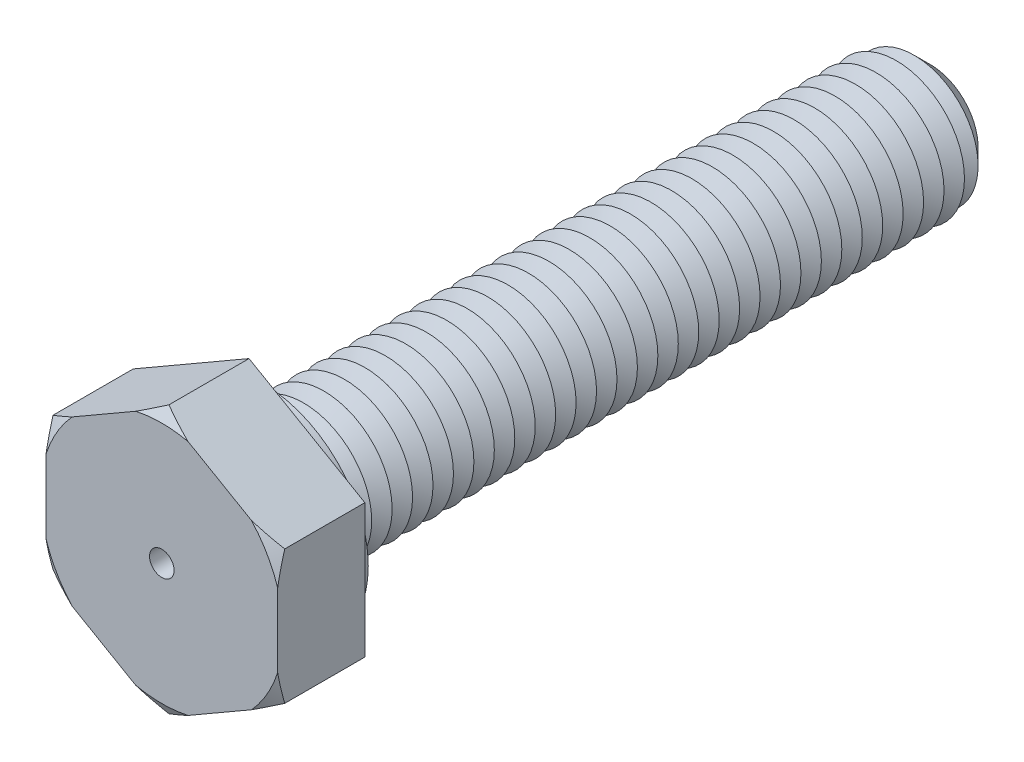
SolidWorks part; units mm, degrees
ref_plane "Front Plane" through (0, 0, 0) normal (0, 0, 1) x (1, 0, 0)
ref_plane "Top Plane" through (0, 0, 0) normal (0, 1, 0) x (1, 0, 0)
ref_plane "Right Plane" through (0, 0, 0) normal (1, 0, 0) x (0, 0, -1)
sketch "Sketch2" plane through (0, 0, 0) normal (0, 0, 1) x (1, 0, 0)
  line L1 (0, 9.815) -> (-8.5, 4.9075)
  line L2 (-8.5, 4.9075) -> (-8.5, -4.9075)
  line L3 (-8.5, -4.9075) -> (0, -9.815)
  line L4 (0, -9.815) -> (8.5, -4.9075)
  line L5 (8.5, -4.9075) -> (8.5, 4.9075)
  line L6 (8.5, 4.9075) -> (0, 9.815)
  circle A0 centre (0, 0) radius 8.5 construction
  dimension "D1" = 17
extrude "Boss-Extrude1" add sketch "Sketch2" along normal blind 6.4
sketch "Sketch3" plane through (0, 0, 0) normal (0, 0, -1) x (-1, 0, 0)
  circle A0 centre (0, 0) radius 5
  dimension "D1" = 10
extrude "Boss-Extrude2" add sketch "Sketch3" along normal blind 50
sketch "Sketch4" plane through (0, 0, 0) normal (0, 0, -1) x (-1, 0, 0)
  circle A0 centre (0, 0) radius 7.75
  dimension "D1" = 15.5
extrude "Boss-Extrude3" add sketch "Sketch4" along normal blind 1
sketch "Sketch5" plane through (0, 0, 0) normal (1, 0, 0) x (0, 0, -1)
  line L0 (-3.2117, 0) -> (6.3192, 0) construction
chamfer "Chamfer1" distance 1.5 angle 45 1 edges at (-5, 0, -50)
sketch "Sketch6" plane through (0, 0, 0) normal (1, 0, 0) x (0, 0, -1)
  line L0 (1, 5) -> (1.75, 3.701)
  line L1 (1.75, 3.701) -> (2.5, 5)
  line L2 (48.5, 5) -> (1, 5) construction
  line L3 (2.5, 5) -> (1, 5)
  dimension "D1" = 1.5
revolve "Cut-Revolve1" cut sketch "Sketch6" angle 360 about L0
pattern_linear "LPattern1" count 32 spacing 1.5 along (0, 0, -1) of "Cut-Revolve1"
sketch "Sketch7" plane through (0, 0, 0) normal (1, 0, 0) x (0, 0, -1)
  line L0 (-6.4, 9.815) -> (-6.4, 8.915)
  line L1 (-6.4, 4.9075) -> (-6.4, 9.815) construction
  line L2 (-6.4, 8.915) -> (-5.8804, 9.815)
  line L3 (-6.4, 9.815) -> (0, 9.815) construction
  line L4 (-5.8804, 9.815) -> (-6.4, 9.815)
  dimension "D1" = 0.9
  dimension "D2" = 30
revolve "Cut-Revolve2" cut sketch "Sketch7" angle 360 about L0
sketch "Sketch8" plane through (0, 0, 6.4) normal (0, 0, 1) x (1, 0, 0)
  circle A0 centre (0, 0) radius 0.9
  dimension "D1" = 1.8
extrude "Cut-Extrude1" cut sketch "Sketch8" against normal up to surface (56.4 mm away)
